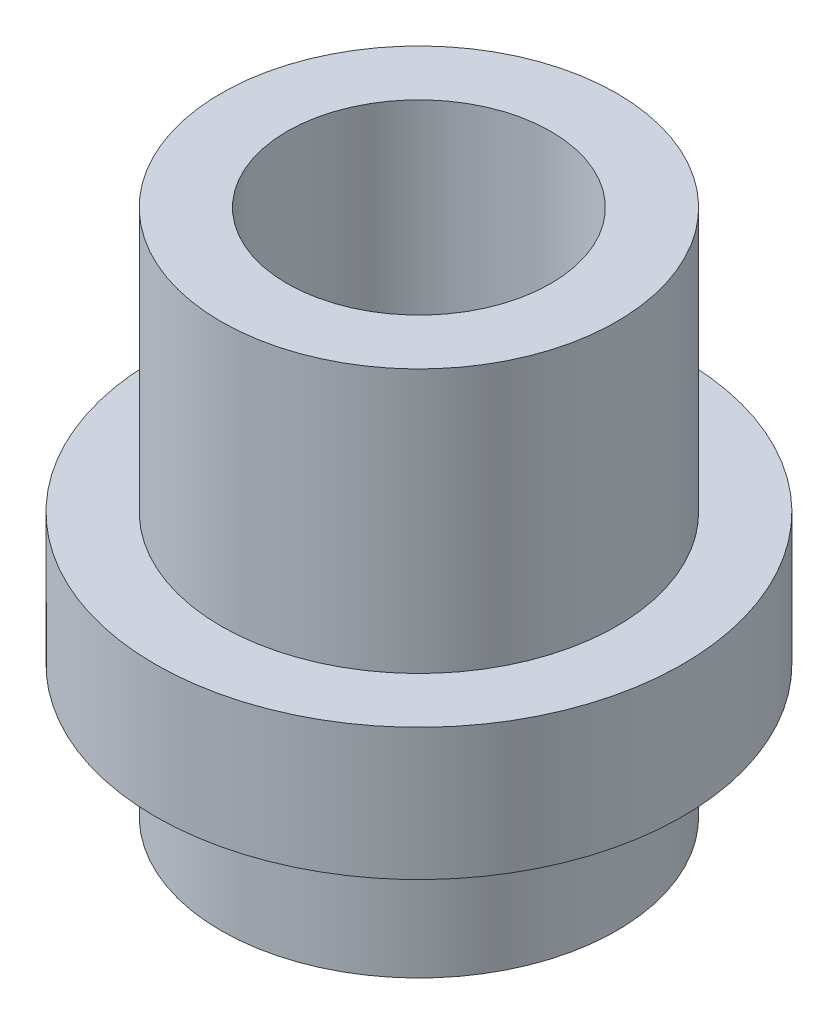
SolidWorks part; units mm, degrees
ref_plane "Plan de face" through (0, 0, 0) normal (0, 0, 1) x (1, 0, 0)
ref_plane "Plan de dessus" through (0, 0, 0) normal (0, 1, 0) x (1, 0, 0)
ref_plane "Plan de droite" through (0, 0, 0) normal (1, 0, 0) x (0, 0, -1)
sketch "Esquisse1" plane through (0, 0, 0) normal (0, 0, 1) x (1, 0, 0)
  line L0 (0, 11.0837) -> (0, -12.8571) construction
  line L1 (0, 10) -> (-7.5, 10)
  line L2 (-7.5, 10) -> (-7.5, 0)
  line L3 (-7.5, 0) -> (-10, 0)
  line L4 (-10, 0) -> (-10, -5)
  line L5 (-10, -5) -> (-7.5, -5)
  line L6 (-7.5, -5) -> (-7.5, -10)
  line L7 (-7.5, -10) -> (0, -10)
  line L8 (0, 10) -> (0, -10)
  dimension "D1" = 20
  dimension "D2" = 10
  dimension "D3" = 5
  dimension "D4" = 7.5
  dimension "D5" = 10
revolve "Révolution1" add sketch "Esquisse1" angle 360 about L0
sketch "Esquisse2" plane through (0, 10, 0) normal (0, 1, 0) x (1, 0, 0)
  circle A0 centre (0, 0) radius 5
  dimension "D1" = 10
extrude "Enlèv. mat.-Extru.1" cut sketch "Esquisse2" against normal through all
